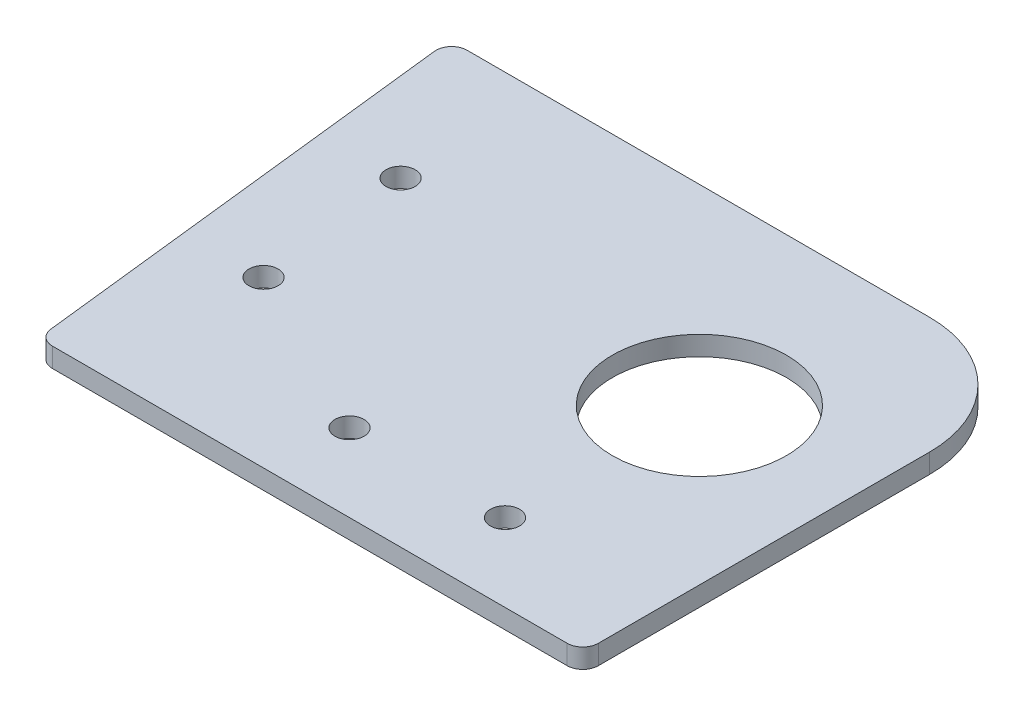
SolidWorks part; units mm, degrees
ref_plane "Front Plane" through (0, 0, 0) normal (0, 0, 1) x (1, 0, 0)
ref_plane "Top Plane" through (0, 0, 0) normal (0, 1, 0) x (1, 0, 0)
ref_plane "Right Plane" through (0, 0, 0) normal (1, 0, 0) x (0, 0, -1)
sketch "Sketch1" plane through (0, 0, 0) normal (0, 1, 0) x (1, 0, 0)
  line L0 (0, 0) -> (8.5468, -75.7192)
  line L1 (8.5468, -75.7192) -> (97.4468, -75.7192)
  line L2 (0, 0) -> (97.4468, 0)
  line L3 (97.4468, 0) -> (97.4468, -75.7192)
  line L4 (97.4468, -50.3192) -> (5.6798, -50.3192) construction
  line L5 (25.5613, 0) -> (34.1081, -75.7192) construction
  circle A0 centre (72.0468, -31.2692) radius 14.224
  dimension "D6" = 28.448
  dimension "D1" = 96.44
  dimension "D2" = 76.2
  dimension "D3" = 88.9
  dimension "D4" = 44.45
  dimension "D5" = 25.4
  dimension "D7" = 25.4
  dimension "D8" = 25.4
extrude "Boss-Extrude1" add sketch "Sketch1" along normal blind 3.175
fillet "Fillet1" radius 2.54 3 edges at (0, 1.5875, 0) (97.4468, 1.5875, 75.7192) (8.5468, 1.5875, 75.7192)
fillet "Fillet2" radius 19.05 1 edges at (97.4468, 1.5875, 0)
sketch "Sketch2" plane through (0, 3.175, 0) normal (0, 1, 0) x (1, 0, 0)
  line L0 (0, 0) -> (8.5468, -75.7192) construction
  line L1 (0.3189, -2.8249) -> (8.2923, -73.4641) construction
  line L2 (80.5835, -75.7192) -> (8.5468, -75.7192) construction
  line L3 (10.8162, -75.7192) -> (94.9068, -75.7192) construction
  circle A0 centre (46.6468, -63.0192) radius 2.3812
  circle A1 centre (72.0468, -63.0192) radius 2.3813
  dimension "D1" = 4.7625
  dimension "D2" = 38.1
  dimension "D3" = 12.7
  dimension "D4" = 25.4
extrude "Cut-Extrude1" cut sketch "Sketch2" against normal blind 3.175
sketch "Sketch3" plane through (0, 3.175, 0) normal (0, 1, 0) x (1, 0, 0)
  circle A0 centre (18.3391, -48.7587) radius 2.3813
  circle A1 centre (15.4895, -23.519) radius 2.3813
  circle A2 centre (15.4895, -23.519) radius 2.4892 construction
  circle A3 centre (18.3391, -48.7587) radius 2.4892 construction
  dimension "D1" = 4.7625
extrude "Cut-Extrude2" cut sketch "Sketch3" against normal blind 3.175
